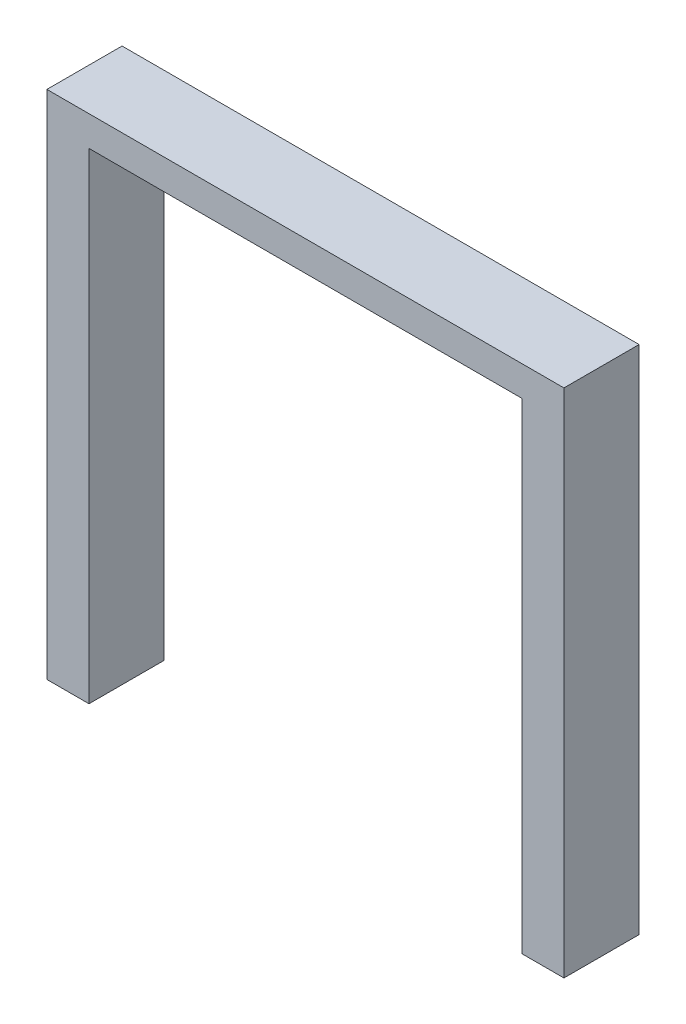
SolidWorks part; units mm, degrees
ref_plane "Front Plane" through (0, 0, 0) normal (0, 0, 1) x (1, 0, 0)
ref_plane "Top Plane" through (0, 0, 0) normal (0, 1, 0) x (1, 0, 0)
ref_plane "Right Plane" through (0, 0, 0) normal (1, 0, 0) x (0, 0, -1)
sketch "Sketch1" plane through (0, 0, 0) normal (0, 0, 1) x (1, 0, 0)
  line L2 (-36, 0) -> (-43, 0)
  line L3 (-36, 0) -> (-36, 80)
  line L4 (-43, 0) -> (-43, 85)
  line L5 (0, 0) -> (0, 112.908) construction
  line L6 (-43, 85) -> (43, 85)
  line L7 (-36, 80) -> (36, 80)
  line L8 (43, 0) -> (43, 85)
  line L9 (36, 0) -> (36, 80)
  line L10 (36, 0) -> (43, 0)
  point P11 (0, 80)
  point P15 (0, 85)
  dimension "D1" = 7
  dimension "D2" = 85
  dimension "D3" = 36
  dimension "D6" = 5
extrude "Boss-Extrude1" add sketch "Sketch1" along normal mid plane 12.5
